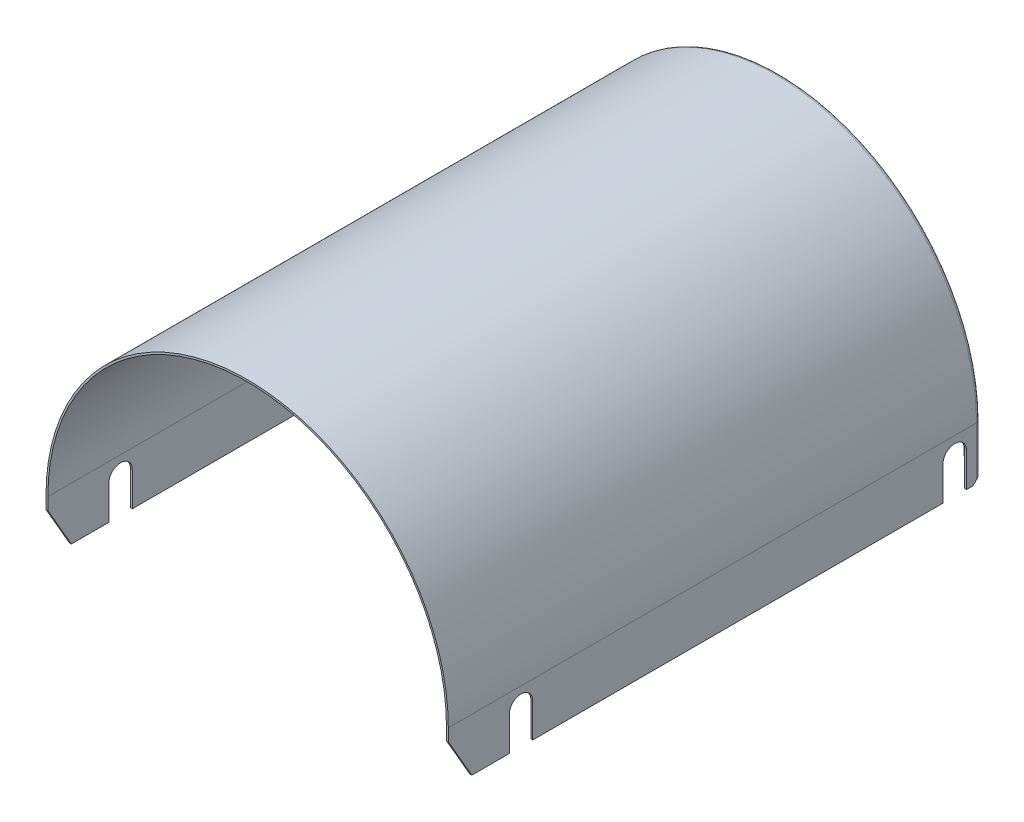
SolidWorks part; units mm, degrees
ref_plane "Plan de face" through (0, 0, 0) normal (0, 0, 1) x (1, 0, 0)
ref_plane "Plan de dessus" through (0, 0, 0) normal (0, 1, 0) x (1, 0, 0)
ref_plane "Plan de droite" through (0, 0, 0) normal (1, 0, 0) x (0, 0, -1)
sketch "Esquisse1" plane through (0, 0, 0) normal (0, 0, 1) x (1, 0, 0)
  arc A0 (-85, 0) -> (85, 0) centre (0, 0) cw
  dimension "D2" = 85
extrude "Extru.-Mince1" add sketch "Esquisse1" along normal blind 226 thin
sketch "Esquisse8" plane through (0, 0, 0) normal (0, -1, 0) x (1, 0, 0)
  line L4 (85, 0) -> (85.8, 0)
  line L5 (85.8, 0) -> (85.8, 226)
  line L6 (85.8, 226) -> (85, 226)
  line L7 (85, 226) -> (85, 0)
  line L8 (85, 0) -> (85.8, 0)
  line L9 (85.8, 0) -> (85.8, 226)
  line L10 (85.8, 226) -> (85, 226)
  line L11 (85, 226) -> (85, 0)
  dimension "D1" = 0
extrude "Extrusion2" add sketch "Esquisse8" along normal blind 22.5
mirror "Symétrie1" about plane through (0, 0, 0) normal (1, 0, 0) of "Extrusion2"
sketch "Esquisse2" plane through (0, 0, 0) normal (1, 0, 0) x (0, 0, -1)
  line L0 (-200, -22.5) -> (-200, -8)
  line L2 (-5, -22.5) -> (-5, -8)
  line L3 (-190, -8) -> (-190, -22.5)
  line L6 (-15, -8) -> (-15, -22.5)
  line L7 (0, -22.5) -> (-226, -22.5) construction
  line L8 (-190, -22.5) -> (-200, -22.5)
  line L9 (-15, -22.5) -> (-5, -22.5)
  line L11 (-226, 85.8) -> (-226, 0) construction
  arc A0 (-200, -8) -> (-190, -8) centre (-195, -8) cw
  arc A1 (-5, -8) -> (-15, -8) centre (-10, -8) ccw
  dimension "D2" = 5
  dimension "D5" = 8
  dimension "D4" = 5
  dimension "D1" = 185
  dimension "D3" = 31
extrude "Enlèv. mat.-Extru.1" cut sketch "Esquisse2" against normal through all and the other way through all
sketch "Esquisse3" plane through (0, 0, 0) normal (1, 0, 0) x (0, 0, -1)
  line L0 (-226, -5.1795) -> (-226, -22.5)
  line L1 (-200, -22.5) -> (-226, -22.5) construction
  line L2 (-216, -22.5) -> (-226, -22.5)
  line L3 (-226, 85.8) -> (-226, 0) construction
  line L5 (-216, -22.5) -> (-226, -5.1795)
  dimension "D1" = 60
  dimension "D2" = 10
extrude "Enlèv. mat.-Extru.3" cut sketch "Esquisse3" against normal through all and the other way through all
sketch "Esquisse5" plane through (0, 0, 0) normal (0, 0, 1) x (1, 0, 0)
  line L0 (85.8, 0) -> (85.8, -22.5)
  line L1 (85.8, -22.5) -> (79.8, -22.5)
  line L2 (79.8, -22.5) -> (79.8, 0)
  line L3 (-85.8, 0) -> (-85.8, -22.5)
  line L4 (-85.8, -22.5) -> (-85.8, 0) construction
  line L5 (-85.8, -22.5) -> (-79.8, -22.5)
  line L6 (-79.8, -22.5) -> (-79.8, 0)
  arc A0 (85.8, 0) -> (-85.8, 0) centre (0, 0) ccw construction
  arc A1 (85.8, 0) -> (-85.8, 0) centre (0, 0) ccw
  arc A2 (79.8, 0) -> (-79.8, 0) centre (0, 0) ccw
  dimension "D1" = 6
extrude "Extrusion1" add sketch "Esquisse5" against normal blind 0.8
fillet "Congé1" radius 1.5 3 edges at (0, 85.8, -0.8) (85.8, -11.25, -0.8) (-85.8, -11.25, -0.8)
fillet "Congé2" radius 0.7 3 edges at (0, 85, 0)
sketch "Esquisse6" plane through (0, 0, 0) normal (1, 0, 0) x (0, 0, -1)
  line L0 (0.8, -22.5) -> (0.8, -19.5)
  line L1 (0.8, 0) -> (0.8, 84.3) construction
  line L2 (0.8, -19.5) -> (-2.2, -22.5)
  line L4 (-2.2, -22.5) -> (0.8, -22.5)
  line L5 (-0.7, -22.5) -> (-5, -22.5) construction
  line L6 (0.8, 0) -> (0.8, -22.5) construction
  dimension "D1" = 3
  dimension "D2" = 3
extrude "Enlèv. mat.-Extru.4" cut sketch "Esquisse6" against normal through all and the other way through all
sketch "Esquisse7" plane through (0, 0, -0.8) normal (0, 0, -1) x (-1, 0, 0)
  line L0 (-85, -22.5) -> (-85.8, -22.5) construction
  line L1 (-79.8, 0) -> (-79.8, -19.5) construction
  line L2 (-84.3, -20.3) -> (-79.8, -15.5)
  line L4 (-84.3, -20.3) -> (-84.3, -22.5)
  line L5 (-84.3, -22.5) -> (-79.8, -22.5)
  line L6 (-84.3, -20.3) -> (-79.8, -20.3) construction
  line L7 (-79.8, -15.5) -> (-79.8, -22.5)
  dimension "D1" = 7
extrude "Enlèv. mat.-Extru.5" cut sketch "Esquisse7" against normal through all
mirror "Symétrie2" about plane through (0, 0, 0) normal (1, 0, 0) of "Enlèv. mat.-Extru.5"
